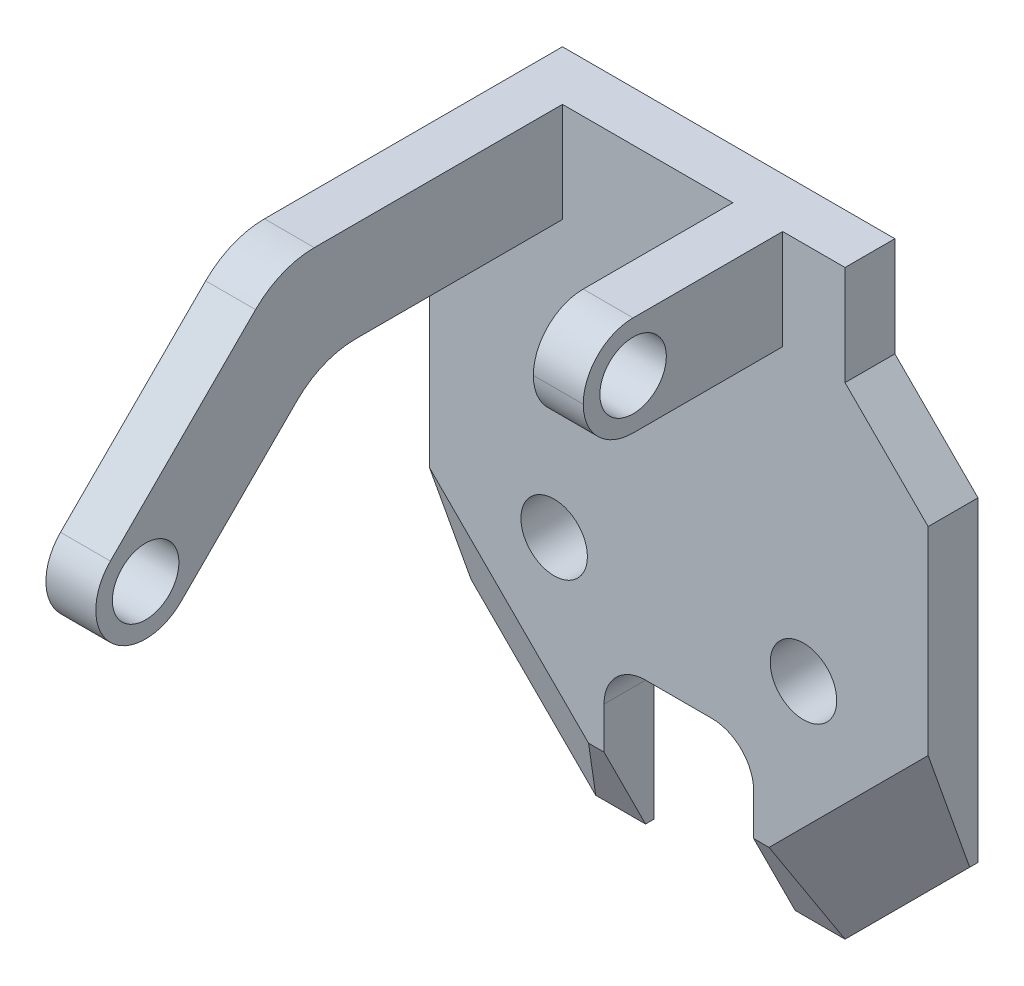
SolidWorks part; units mm, degrees
ref_plane "Ön Düzlem" through (0, 0, 0) normal (0, 0, 1) x (1, 0, 0)
ref_plane "Üst Düzlem" through (0, 0, 0) normal (0, 1, 0) x (1, 0, 0)
ref_plane "Sağ Düzlem" through (0, 0, 0) normal (1, 0, 0) x (0, 0, -1)
sketch "Çizim1" plane through (0, 0, 0) normal (0, 0, 1) x (1, 0, 0)
  line L0 (-2.6055, 3.0297) -> (-42.6055, 3.0297)
  line L1 (-42.6055, 3.0297) -> (-42.6055, -8.9703)
  line L2 (-42.6055, -8.9703) -> (-52.6055, -18.9703)
  line L3 (-52.6055, -18.9703) -> (-52.6055, -56.9703)
  line L4 (-52.6055, -56.9703) -> (-37.6055, -71.9703)
  line L5 (-37.6055, -71.9703) -> (-7.6055, -71.9703)
  line L6 (-7.6055, -71.9703) -> (7.3945, -56.9703)
  line L7 (7.3945, -56.9703) -> (7.3945, -18.9703)
  line L8 (7.3945, -18.9703) -> (-2.6055, -8.9703)
  line L9 (-2.6055, -8.9703) -> (-2.6055, 3.0297)
  dimension "D1" = 75
  dimension "D2" = 40
  dimension "D3" = 12
  dimension "D4" = 12
  dimension "D5" = 10
  dimension "D6" = 10
  dimension "D7" = 10
  dimension "D8" = 10
  dimension "D9" = 60
  dimension "D10" = 15
  dimension "D11" = 15
extrude "Yükseklik-Ekstrüzyon1" add sketch "Çizim1" along normal blind 6
sketch "Çizim2" plane through (-2.6055, 0, 0) normal (1, 0, 0) x (0, 0, -1)
  line L0 (-37.9584, -11.8993) -> (-51.9112, -25.8521)
  line L1 (0, 3.0297) -> (-35.8579, 3.0297)
  line L2 (0, 3.0297) -> (0, -8.9703)
  line L3 (0, -8.9703) -> (-30.8873, -8.9703)
  line L5 (-42.9289, 0.1007) -> (-60.3965, -17.3668)
  line L6 (-6, -8.9703) -> (0, -8.9703) construction
  arc A0 (-60.3965, -17.3668) -> (-51.9112, -25.8521) centre (-56.1538, -21.6095) ccw
  arc A1 (-30.8873, -8.9703) -> (-37.9584, -11.8993) centre (-30.8873, -18.9703) ccw
  arc A2 (-35.8579, 3.0297) -> (-42.9289, 0.1007) centre (-35.8579, -6.9703) ccw
  dimension "D2" = 10
  dimension "D3" = 12
  dimension "D1" = 135
extrude "Yükseklik-Ekstrüzyon2" add sketch "Çizim2" against normal blind 6
sketch "Çizim3" plane through (0, 0, 6) normal (0, 0, 1) x (1, 0, 0)
  line L0 (-37.6055, -71.9703) -> (-7.6055, -71.9703) construction
  line L1 (-31.6055, -91.9703) -> (-13.6055, -91.9703)
  line L2 (-31.6055, -91.9703) -> (-31.6055, -51.9703)
  line L3 (-31.6055, -51.9703) -> (-13.6055, -51.9703)
  line L4 (-13.6055, -91.9703) -> (-13.6055, -51.9703)
  line L5 (-31.6055, -91.9703) -> (-13.6055, -51.9703) construction
  line L6 (-31.6055, -51.9703) -> (-13.6055, -91.9703) construction
  point P0 (-22.6055, -71.9703)
extrude "Kes-Ekstrüzyon1" cut sketch "Çizim3" against normal blind 6
fillet "Radyus1" radius 5 2 edges at (-13.6055, -51.9703, 3) (-31.6055, -51.9703, 3)
chamfer "Pah1" distance 5 distance2 10 4 edges at (-0.1055, -64.4703, 6) (-10.6055, -71.9703, 6) (-45.1055, -64.4703, 6) (-34.6055, -71.9703, 6)
sketch "Çizim4" plane through (-8.6055, 0, 0) normal (-1, 0, 0) x (0, 0, 1)
  circle A0 centre (56.1538, -21.6095) radius 5
  dimension "D1" = 10
extrude "Kes-Ekstrüzyon2" cut sketch "Çizim4" against normal blind 6
ref_plane "Düzlem1" through (-22.6055, 0, 0) normal (-1, 0, 0) x (0, 0, 1)
mirror "Aynalama1" about plane through (-22.6055, 0, 0) normal (-1, 0, 0) of "Yükseklik-Ekstrüzyon2"
sketch "Çizim5" plane through (-8.6055, 0, 0) normal (-1, 0, 0) x (0, 0, 1)
  line L1 (6, 3.0297) -> (82.0094, 3.0297)
  line L2 (6, 3.0297) -> (6, -35.9328)
  line L3 (6, -35.9328) -> (82.0094, -35.9328)
  line L4 (82.0094, 3.0297) -> (82.0094, -35.9328)
extrude "Kes-Ekstrüzyon3" cut sketch "Çizim5" against normal blind 23
sketch "Çizim6" plane through (-42.6055, 0, 0) normal (-1, 0, 0) x (0, 0, 1)
  circle A0 centre (56.1538, -21.6095) radius 4
  dimension "D1" = 8
extrude "Kes-Ekstrüzyon4" cut sketch "Çizim6" against normal blind 23
ref_plane "Düzlem2" through (-10.1055, 0, 0) normal (1, 0, 0) x (0, 0, -1)
sketch "Çizim7" plane through (-10.1055, 0, 0) normal (1, 0, 0) x (0, 0, -1)
  line L0 (-6, 3.0297) -> (-6, -8.9703) construction
  line L1 (-6, 3.0297) -> (-6, -8.9703)
  line L3 (-6, 3.0297) -> (-30, 3.0297)
  line L4 (-6, 3.0297) -> (-6, -8.9703)
  line L5 (-6, -8.9703) -> (-30, -8.9703)
  line L6 (-30, 3.0297) -> (-30, -8.9703)
  dimension "D1" = 24
extrude "Yükseklik-Ekstrüzyon3" add sketch "Çizim7" against normal blind 6 contours L3 L6 L5 L1
fillet "Radyus2" radius 6 2 edges at (-13.1055, -8.9703, 30) (-13.1055, 3.0297, 30)
hole_wizard "Delik1" positions "Çizim8" profile "Çizim9" legacy
sketch "Çizim8" plane through (-2.6055, 0, 0) normal (1, 0, 0) x (0, 0, -1)
  point P0 (-24, -2.9703)
sketch "Çizim9" plane through (-2.6055, -2.9703, 24) normal (0, 1, 0) x (0, 0, -1)
  line L0 (0, 0) -> (0, 20)
  line L1 (0, 20) -> (4, 20)
  line L2 (4, 20) -> (4, 0)
  line L3 (4, 0) -> (0, 0)
  line L4 (0, 110) -> (0, -10) construction
  dimension "Diameter" = 8
  dimension "Depth" = 20
sketch "Çizim10" plane through (0, 0, 6) normal (0, 0, 1) x (1, 0, 0)
  line L0 (-52.6055, -18.9703) -> (-52.6055, -42.8282) construction
  line L1 (7.3945, -42.8282) -> (7.3945, -18.9703) construction
  circle A0 centre (-37.6055, -42.5992) radius 4
  circle A1 centre (-7.6055, -42.5992) radius 4
  dimension "D1" = 15
  dimension "D2" = 15
extrude "Kes-Ekstrüzyon5" cut sketch "Çizim10" against normal blind 10
